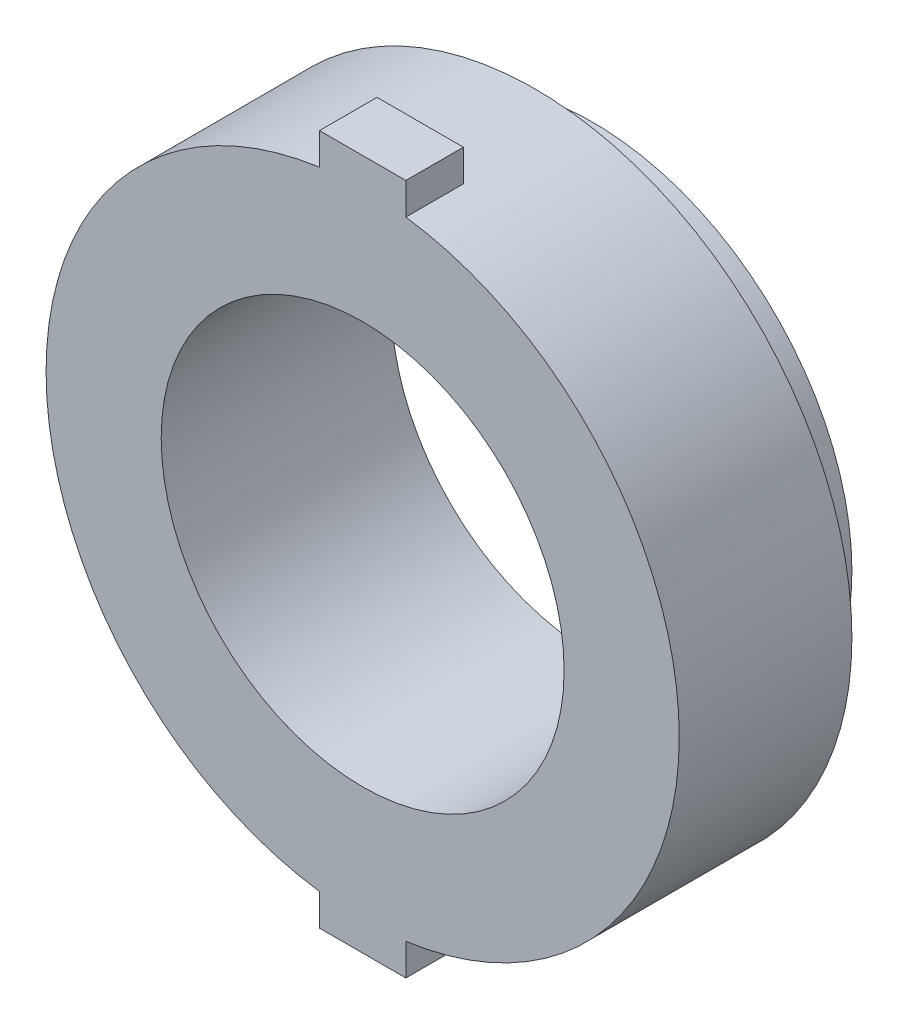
SolidWorks part; units mm, degrees
ref_plane "Plan1" through (0, 0, 0) normal (0, 0, 1) x (1, 0, 0)
ref_plane "Plan2" through (0, 0, 0) normal (0, 1, 0) x (1, 0, 0)
ref_plane "Plan3" through (0, 0, 0) normal (1, 0, 0) x (0, 0, -1)
sketch "Esquisse1" plane through (0, 0, 0) normal (0, 0, 1) x (1, 0, 0)
  circle A0 centre (0, 0) radius 5.5
  circle A1 centre (0, 0) radius 3.5
  dimension "D1" = 11
  dimension "D2" = 7
extrude "Base-Extrusion" add sketch "Esquisse1" along normal blind 3
sketch "Esquisse2" plane through (0, 0, 3) normal (0, 0, 1) x (1, 0, 0)
  line L0 (0.75, 6) -> (0.75, 4.472)
  line L1 (-0.75, 6) -> (0.75, 6)
  line L2 (0.75, 4.472) -> (-0.75, 4.472)
  line L3 (-0.75, -6) -> (0.75, -6)
  line L4 (-0.75, 4.472) -> (-0.75, 6)
  line L5 (0.75, -6) -> (0.75, -4.2565)
  line L6 (0.75, -4.2565) -> (-0.75, -4.2565)
  line L7 (-0.75, -4.2565) -> (-0.75, -6)
  dimension "D1" = 1.5
  dimension "D2" = 0.75
  dimension "D3" = 12
  dimension "D4" = 6
extrude "Boss.-Extru.1" add sketch "Esquisse2" against normal blind 1
sketch "Esquisse3" plane through (0, 0, 0) normal (0, 0, -1) x (-1, 0, 0)
  circle A0 centre (0, 0) radius 4.5
  circle A1 centre (0, 0) radius 3.5
  dimension "D1" = 9
extrude "Boss.-Extru.2" add sketch "Esquisse3" along normal blind 1
